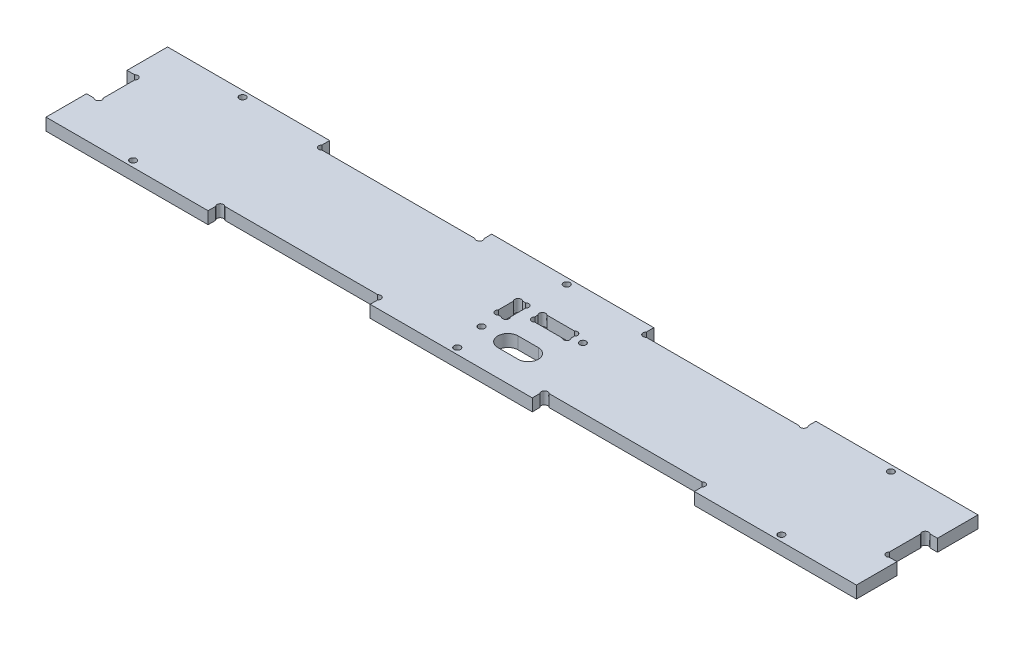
SolidWorks part; units mm, degrees
ref_plane "Plan de face" through (0, 0, 0) normal (0, 0, 1) x (1, 0, 0)
ref_plane "Plan de dessus" through (0, 0, 0) normal (0, 1, 0) x (1, 0, 0)
ref_plane "Plan de droite" through (0, 0, 0) normal (1, 0, 0) x (0, 0, -1)
sketch "Esquisse1" plane through (0, 0, 0) normal (0, 1, 0) x (1, 0, 0)
  line L0 (242.6104, 0) -> (-73.75, 0) construction
  line L1 (0, 20.53) -> (0, 85.718) construction
  line L2 (242.6104, 30) -> (-208.8742, 30) construction
  line L3 (-200, 30) -> (-120, 30)
  line L4 (-200, 30) -> (-200, 10)
  line L5 (-200, -30) -> (-120, -30)
  line L6 (200, 30) -> (200, 10)
  line L7 (-200, 30) -> (200, -30) construction
  line L8 (-200, -30) -> (200, 30) construction
  line L9 (242.6104, -30) -> (-208.8742, -30) construction
  line L10 (200, 85.718) -> (200, -57.4924) construction
  line L11 (-200, 43.1065) -> (-200, -57.4924) construction
  line L12 (218.5247, 24) -> (-63.5463, 24) construction
  line L13 (40, 59.0419) -> (40, 35.7819) construction
  line L14 (80, 73.913) -> (80, 33.494) construction
  line L15 (40, 24) -> (55.3419, 39.3419) construction
  line L16 (40, 30) -> (40, 26.2627)
  line L17 (120, 30) -> (120, 26.2627)
  line L18 (42.2627, 24) -> (117.7373, 24)
  line L19 (120, 30) -> (200, 30)
  line L20 (194, 66.1477) -> (194, -17.0938) construction
  line L21 (189.4171, 10) -> (218.5247, 10) construction
  line L22 (194, 10) -> (209.2061, -5.2061) construction
  line L23 (196.2627, 10) -> (200, 10)
  line L24 (196.2627, -10) -> (200, -10)
  line L25 (194, -7.7373) -> (194, 7.7373)
  line L26 (200, -10) -> (200, -30)
  line L27 (120, -30) -> (120, -26.2627)
  line L28 (42.2627, -24) -> (117.7373, -24)
  line L29 (40, -30) -> (40, -26.2627)
  line L30 (120, -30) -> (200, -30)
  line L31 (-194, -7.7373) -> (-194, 7.7373)
  line L32 (-196.2627, -10) -> (-200, -10)
  line L33 (-196.2627, 10) -> (-200, 10)
  line L34 (-40, -30) -> (-40, -26.2627)
  line L35 (-42.2627, -24) -> (-117.7373, -24)
  line L36 (-120, -30) -> (-120, -26.2627)
  line L37 (-42.2627, 24) -> (-117.7373, 24)
  line L38 (-120, 30) -> (-120, 26.2627)
  line L39 (-40, 30) -> (-40, 26.2627)
  line L40 (-40, -30) -> (40, -30)
  line L41 (-40, 30) -> (40, 30)
  line L42 (-200, -10) -> (-200, -30)
  line L43 (-2.5589, 27) -> (10.03, 27) construction
  line L44 (-4, -33.0271) -> (-4, -45.9733) construction
  line L45 (-28.0921, 9) -> (61.3569, 9) construction
  line L46 (-28.0921, 3) -> (61.3569, 3) construction
  line L47 (24, 9) -> (12.1551, -2.8449) construction
  line L48 (15, 14.5154) -> (15, -57.4924) construction
  line L49 (24, 15.433) -> (24, -45.9733) construction
  line L50 (35.6902, 6) -> (4.3961, 6) construction
  line L51 (8.2627, 9) -> (21.7373, 9)
  line L52 (6, 6.7373) -> (6, 5.2627)
  line L53 (24, 6.7373) -> (24, 5.2627)
  line L54 (8.2627, 3) -> (21.7373, 3)
  line L55 (-7.8681, -12) -> (61.3569, -12) construction
  line L56 (10, -7) -> (20, -7)
  line L57 (36.48, -17) -> (-13.4526, -17) construction
  line L58 (20, -17) -> (10, -17)
  line L59 (-6, 18.6576) -> (-6, -45.9733) construction
  line L60 (0, 18.6576) -> (0, -45.9733) construction
  line L61 (0, 9) -> (-18.2756, -9.2756) construction
  line L62 (-3, -21.4199) -> (-3, -4.0092) construction
  line L63 (-3.7373, 9) -> (-2.2627, 9)
  line L64 (-6, 6.7373) -> (-6, -0.7373)
  line L65 (-3.7373, -3) -> (-2.2627, -3)
  line L66 (0, 6.7373) -> (0, -0.7373)
  arc A0 (40, 26.2627) -> (42.2627, 24) centre (41.1314, 25.1314) ccw
  arc A1 (120, 26.2627) -> (117.7373, 24) centre (118.8686, 25.1314) cw
  arc A2 (196.2627, 10) -> (194, 7.7373) centre (195.1314, 8.8686) ccw
  arc A3 (196.2627, -10) -> (194, -7.7373) centre (195.1314, -8.8686) cw
  arc A4 (120, -26.2627) -> (117.7373, -24) centre (118.8686, -25.1314) ccw
  arc A5 (40, -26.2627) -> (42.2627, -24) centre (41.1314, -25.1314) cw
  arc A6 (-196.2627, -10) -> (-194, -7.7373) centre (-195.1314, -8.8686) ccw
  arc A7 (-196.2627, 10) -> (-194, 7.7373) centre (-195.1314, 8.8686) cw
  arc A8 (-40, -26.2627) -> (-42.2627, -24) centre (-41.1314, -25.1314) ccw
  arc A9 (-120, -26.2627) -> (-117.7373, -24) centre (-118.8686, -25.1314) cw
  arc A10 (-120, 26.2627) -> (-117.7373, 24) centre (-118.8686, 25.1314) ccw
  arc A11 (-40, 26.2627) -> (-42.2627, 24) centre (-41.1314, 25.1314) cw
  circle A12 centre (0, 27) radius 1.6
  circle A13 centre (160, 27) radius 1.6
  circle A14 centre (-160, 27) radius 1.6
  circle A15 centre (0, -27) radius 1.6
  circle A16 centre (160, -27) radius 1.6
  circle A17 centre (-160, -27) radius 1.6
  arc A18 (24, 6.7373) -> (21.7373, 9) centre (22.8686, 7.8686) ccw
  arc A19 (24, 5.2627) -> (21.7373, 3) centre (22.8686, 4.1314) cw
  arc A20 (6, 6.7373) -> (8.2627, 9) centre (7.1314, 7.8686) cw
  arc A21 (6, 5.2627) -> (8.2627, 3) centre (7.1314, 4.1314) ccw
  arc A22 (20, -17) -> (20, -7) centre (20, -12) ccw
  arc A23 (10, -17) -> (10, -7) centre (10, -12) cw
  arc A24 (0, 6.7373) -> (-2.2627, 9) centre (-1.1314, 7.8686) ccw
  circle A25 centre (29, 6) radius 1.6
  arc A26 (-6, 6.7373) -> (-3.7373, 9) centre (-4.8686, 7.8686) cw
  arc A27 (0, -0.7373) -> (-2.2627, -3) centre (-1.1314, -1.8686) cw
  arc A28 (-6, -0.7373) -> (-3.7373, -3) centre (-4.8686, -1.8686) ccw
  circle A29 centre (-3, -12) radius 1.6
  dimension "D7" = 6
  dimension "D10" = 3
  dimension "D11" = 196
  dimension "D18" = 15
  dimension "D19" = 5
  dimension "D20" = 2
  dimension "D22" = 45
  dimension "D1" = 30
  dimension "D2" = 200
  dimension "D3" = 80
  dimension "D4" = 40
  dimension "D5" = 6
  dimension "D6" = 45
  dimension "D8" = 10
  dimension "D9" = 45
  dimension "D12" = 19
  dimension "D13" = 9
  dimension "D14" = 6
  dimension "D15" = 15
  dimension "D16" = 45
  dimension "D17" = 3
  dimension "D21" = 6
  dimension "D23" = 3
  dimension "D24" = 5
extrude "Boss.-Extru.1" add sketch "Esquisse1" along normal blind 6
